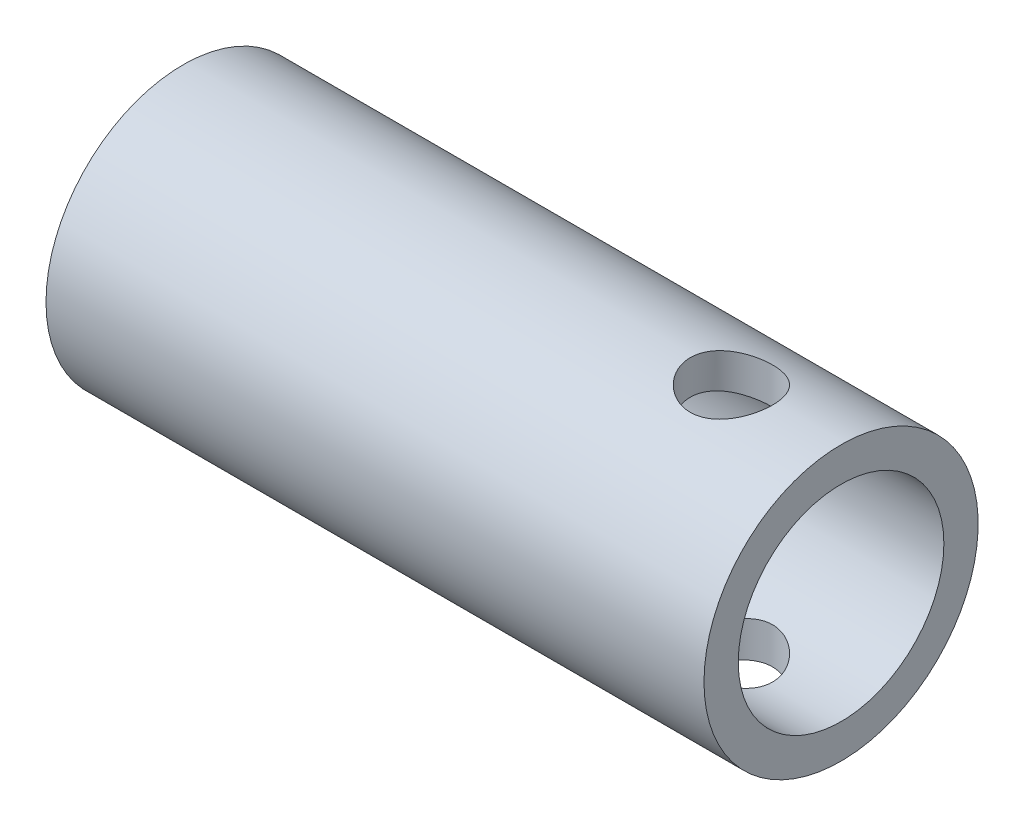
SolidWorks part; units mm, degrees
ref_plane "Front Plane" through (0, 0, 0) normal (0, 0, 1) x (1, 0, 0)
ref_plane "Top Plane" through (0, 0, 0) normal (0, 1, 0) x (1, 0, 0)
ref_plane "Right Plane" through (0, 0, 0) normal (1, 0, 0) x (0, 0, -1)
sketch "Sketch4" plane through (0, 0, 0) normal (0, 1, 0) x (1, 0, 0)
  line L1 (0, 0) -> (-152.4, 0)
  line L2 (0, 0) -> (0, -63.5)
  line L3 (0, -63.5) -> (-152.4, -63.5)
  line L4 (-152.4, 0) -> (-152.4, -63.5)
  dimension "D1" = 152.4
  dimension "D2" = 63.5
extrude "Extrude2" add sketch "Sketch4" along normal blind 63.5
sketch "Sketch5" plane through (0, 63.5, 0) normal (0, 1, 0) x (1, 0, 0)
  circle A0 centre (-25.4, -31.75) radius 9.525
extrude "Cut-Extrude2" cut sketch "Sketch5" against normal blind 63.5
sketch "Sketch6" plane through (-152.4, 0, 0) normal (-1, 0, 0) x (0, 0, 1)
  circle A0 centre (31.75, 31.75) radius 31.75
extrude "Cut-Extrude3" cut sketch "Sketch6" against normal blind 152.4 flip side to cut
sketch "Sketch7" plane through (-152.4, 0, 0) normal (-1, 0, 0) x (0, 0, 1)
  circle A0 centre (31.75, 31.75) radius 23.8125
extrude "Cut-Extrude4" cut sketch "Sketch7" against normal blind 152.4
